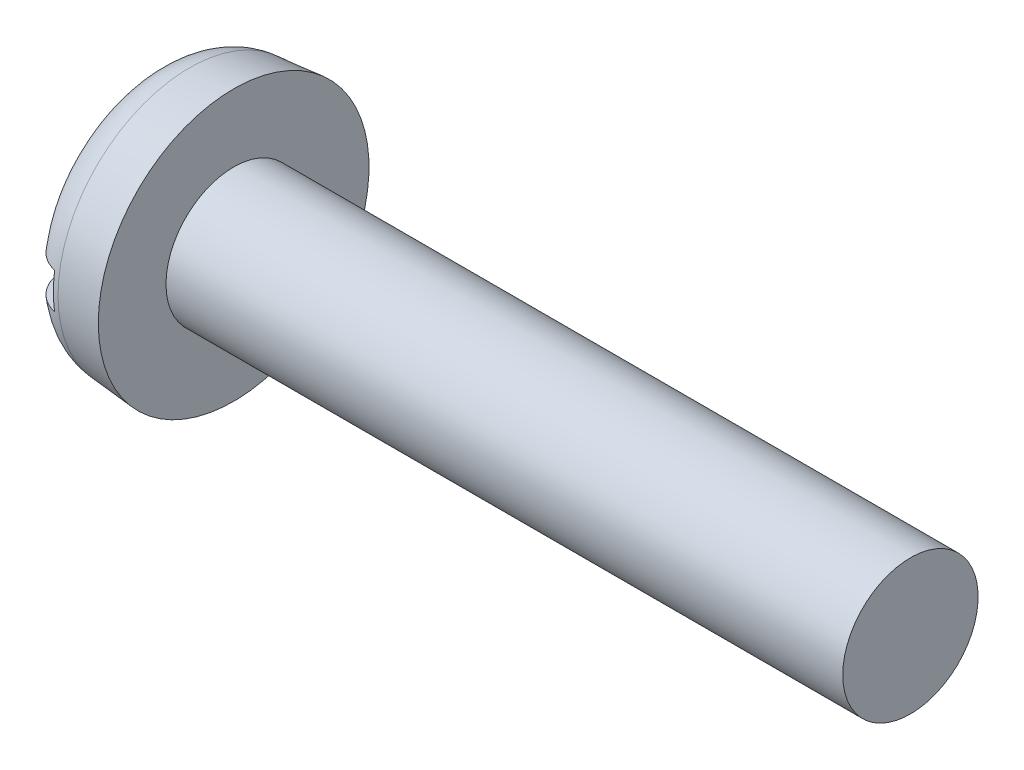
SolidWorks part; units mm, degrees
ref_plane "Plane1" through (0, 0, 0) normal (0, 0, 1) x (1, 0, 0)
ref_plane "Plane2" through (0, 0, 0) normal (0, 1, 0) x (1, 0, 0)
ref_plane "Plane3" through (0, 0, 0) normal (1, 0, 0) x (0, 0, -1)
sketch "BodySke" plane through (0, 0, 0) normal (0, 0, 1) x (1, 0, 0)
  line L0 (3.6, 3) -> (3.6, 6)
  line L1 (0, 0) -> (0, 5.685)
  line L2 (-25.4, 0) -> (127, 0) construction
  line L3 (33.6, 0) -> (0, 0)
  line L4 (3.6, 3) -> (33.6, 3)
  line L5 (33.6, 3) -> (33.6, 0)
  line L6 (0, 5.685) -> (3.6, 6)
  line L9 (4.6, 4.5875) -> (4.6, -4.9375) construction
  line L10 (3.6, 6.35) -> (3.6, -3.175) construction
  dimension "Head_ht" = 3.6
  dimension "Diameter" = 6
  dimension "Length" = 30
  dimension "Head_dia" = 12
  dimension "Advance" = 1
  dimension "Thread_nom" = 30
  dimension "Head_side_angle" = 5
revolve "Base-Revolve" add sketch "BodySke"
fillet "Fillet1" [suppressed] radius 0.25
fillet "Fillet2" radius 1.8 1 edges at (0, 0, 5.685)
sketch "Sketch2" plane through (0, 0, 0) normal (1, 0, 0) x (0, 0, -1)
  line L0 (6, -0.8) -> (-6, -0.8)
  line L1 (6, -0.8) -> (6, 0.8)
  line L2 (-6, 0.8) -> (6, 0.8)
  line L3 (-6, 0.8) -> (-6, -0.8)
  dimension "D1" = 12
  dimension "D2" = 6
  dimension "Slot_width" = 1.6
  dimension "D3" = 0.8
extrude "Slot" cut sketch "Sketch2" along normal blind 1.4
sketch "ThdSchSke" plane through (0, 0, 0) normal (0, 0, 1) x (1, 0, 0)
  line L0 (5.6, -2.4455) -> (5.2117, -3)
  line L1 (5.6, -2.4455) -> (5.9883, -3)
  line L2 (5.9883, -3) -> (5.9883, -3.75)
  line L3 (-3.175, 0) -> (5.1513, 0) construction
  line L5 (5.9883, -3.75) -> (5.2117, -3.75)
  line L6 (5.2117, -3.75) -> (5.2117, -3)
  dimension "Thread_minor" = 4.891
  dimension "Diameter" = 6
  dimension "Start" = 5.6
  dimension "SideAngle" = 55
  dimension "VeeAngle" = 70
  dimension "Overcut" = 7.5
revolve "ThreadSchematic" [suppressed] cut sketch "ThdSchSke" angle 360 about L3
pattern_linear "ThdSchPat" [suppressed]
equation "\"D1@Sketch2\" = \"Head_dia@BodySke\""
equation "\"D2@Sketch2\" = \"D1@Sketch2\" / 2"
equation "\"D3@Sketch2\" = \"Slot_width@Sketch2\" / 2"
equation "\"Thread_length@ThreadCosmetic\" = ((sgn( (\"Length@BodySke\" - \"Advance@BodySke\" * 2.0 ) - \"Thread_nom@BodySke\" )-1)*( (\"Length@BodySke\" - \"Advance@BodySke\"  * 2.0) - \"Thread_nom@BodySke\" ))/-2+ \"Thread_"
equation "\"Thread_minor@ThdSchSke\" = \"Thread_minor@ThreadCosmetic\""
equation "\"Diameter@ThdSchSke\" = \"Diameter@BodySke\""
equation "\"Overcut@ThdSchSke\" = \"Diameter@BodySke\" * 1.25"
equation "\"Start@ThdSchSke\" = \"Head_ht@BodySke\" + \"Length@BodySke\" - \"Thread_length@ThreadCosmetic\"  '---Non-countersunk---"
equation "\"Num_threads@ThdSchPat\" = int( \"Thread_length@ThreadCosmetic\" / \"Advance@BodySke\" + 0.999 )  + 1"
equation "\"Advance@ThdSchPat\" = \"Thread_length@ThreadCosmetic\" /  (\"Num_threads@ThdSchPat\" - 1) 'relax it"
